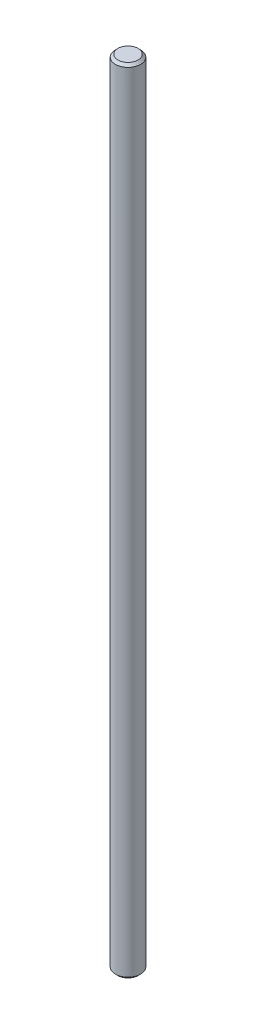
SolidWorks part; units mm, degrees
ref_plane "Front" through (0, 0, 0) normal (0, 0, 1) x (1, 0, 0)
ref_plane "Top" through (0, 0, 0) normal (0, 1, 0) x (1, 0, 0)
ref_plane "Right" through (0, 0, 0) normal (1, 0, 0) x (0, 0, -1)
sketch "Sketch1" plane through (0, 0, 0) normal (0, 1, 0) x (1, 0, 0)
  circle A0 centre (0, 0) radius 2
  dimension "D1" = 4
extrude "Extrude1" add sketch "Sketch1" along normal blind 126
chamfer "Chamfer1" distance 0.4 angle 45 2 edges at (0, 0, 2) (0, 126, 2)
